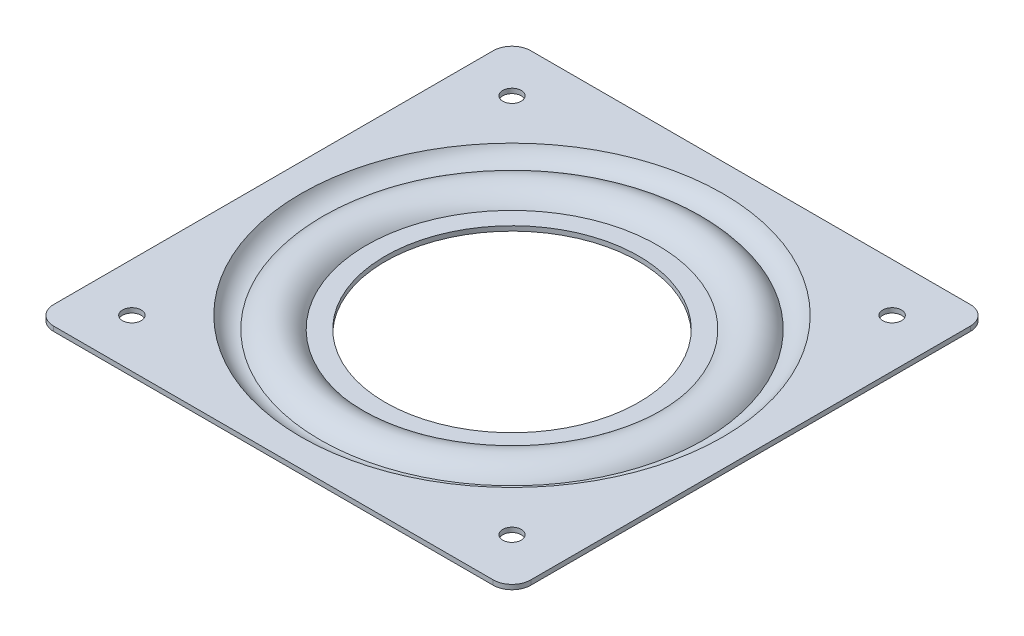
SolidWorks part; units mm, degrees
ref_plane "前视基准面" through (0, 0, 0) normal (0, 0, 1) x (1, 0, 0)
ref_plane "上视基准面" through (0, 0, 0) normal (0, 1, 0) x (1, 0, 0)
ref_plane "右视基准面" through (0, 0, 0) normal (1, 0, 0) x (0, 0, -1)
sketch "草图1" plane through (0, 0, 0) normal (0, 0, 1) x (1, 0, 0)
  line L0 (-36.7805, 0) -> (-35.9228, 0)
  line L1 (0, 6.9172) -> (0, -6.9172) construction
  line L2 (-31, -2.5698) -> (-27, -2.5698)
  line L3 (-35.9228, 0) -> (0, 0) construction
  line L4 (0, 0) -> (43.3864, 0) construction
  line L5 (-43.3864, 0) -> (-36.7805, 0) construction
  line L6 (-31.5531, -3.5698) -> (-27, -3.5698)
  line L7 (-27, -2.5698) -> (-27, -3.5698)
  line L8 (-44.9105, 0) -> (-45.8139, -0.4289)
  arc A0 (-44.9105, 0) -> (-40.8455, -2.5698) centre (-40.8455, 1.9302) ccw
  arc A1 (-40.8455, -2.5698) -> (-31, -2.5698) centre (-35.9228, -6) cw
  arc A2 (-40.8455, -2.5698) -> (-36.8127, -0.0664) centre (-40.8455, 1.9302) ccw construction
  arc A3 (-36.8127, -0.0664) -> (-36.7805, 0) centre (-40.8455, 1.9302) ccw
  arc A4 (-45.8139, -0.4289) -> (-40.2759, -3.5402) centre (-40.8455, 1.9302) ccw
  arc A5 (-40.2759, -3.5402) -> (-31.5531, -3.5698) centre (-35.9228, -6) cw
  point P4 (0, 0)
  point P8 (0, 0)
  dimension "D1" = 4.5
  dimension "D2" = 6
  dimension "D3" = 27
  dimension "D4" = 4
revolve "旋转1" add sketch "草图1" angle 360 about L1
sketch "草图2" plane through (0, 0, 0) normal (0, 1, 0) x (1, 0, 0)
  line L1 (-46.8, 50.8) -> (46.8, 50.8)
  line L2 (-50.8, 46.8) -> (-50.8, -46.8)
  line L3 (-46.8, -50.8) -> (46.8, -50.8)
  line L4 (50.8, 46.8) -> (50.8, -46.8)
  line L5 (-50.8, 50.8) -> (50.8, -50.8) construction
  line L6 (-50.8, -50.8) -> (50.8, 50.8) construction
  circle A0 centre (0, 0) radius 44.9105 construction
  circle A1 centre (0, 0) radius 44.9105
  arc A2 (-46.8, 50.8) -> (-50.8, 46.8) centre (-46.8, 46.8) ccw
  circle A3 centre (-40.48, 40.48) radius 1.985
  circle A4 centre (40.48, 40.48) radius 1.985
  arc A5 (50.8, 46.8) -> (46.8, 50.8) centre (46.8, 46.8) ccw
  circle A6 centre (40.48, -40.48) radius 1.985
  arc A7 (46.8, -50.8) -> (50.8, -46.8) centre (46.8, -46.8) ccw
  circle A8 centre (-40.48, -40.48) radius 1.985
  arc A9 (-50.8, -46.8) -> (-46.8, -50.8) centre (-46.8, -46.8) ccw
  point P12 (0, 0)
  point P13 (0, 0)
  point P14 (0, 0)
  point P32 (0, 0)
  dimension "D3" = 4
  dimension "D4" = 3.97
  dimension "D5" = 4
  dimension "D1" = 90
  dimension "D2" = 101.6
  dimension "D6" = 57.2474
extrude "凸台-拉伸1" add sketch "草图2" against normal blind 1
